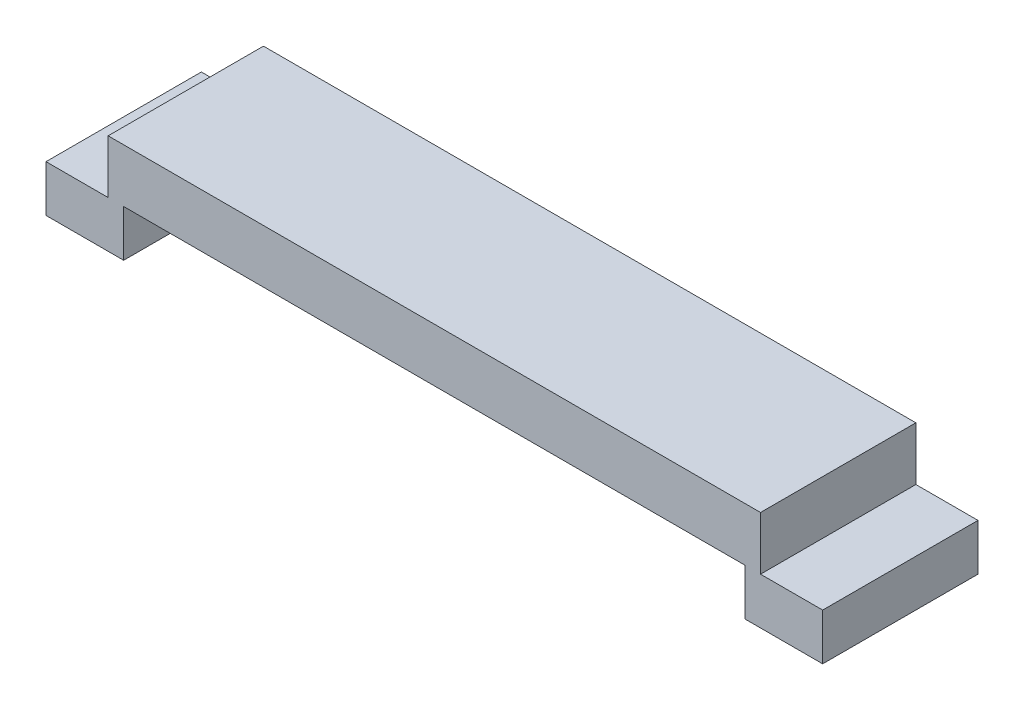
SolidWorks part; units mm, degrees
ref_plane "Front Plane" through (0, 0, 0) normal (0, 0, 1) x (1, 0, 0)
ref_plane "Top Plane" through (0, 0, 0) normal (0, 1, 0) x (1, 0, 0)
ref_plane "Right Plane" through (0, 0, 0) normal (1, 0, 0) x (0, 0, -1)
sketch "Sketch1" plane through (0, 0, 0) normal (0, 0, 1) x (1, 0, 0)
  line L0 (0, 0) -> (0, -30)
  line L1 (0, -30) -> (50, -30)
  line L2 (50, -30) -> (50, 0)
  line L3 (50, 0) -> (0, 0)
  line L4 (40, 0) -> (40, 34.4112)
  line L5 (40, 34.4112) -> (460, 34.4112)
  line L6 (460, 34.4112) -> (460, 0)
  line L7 (460, 0) -> (40, 0)
  line L8 (450, 0) -> (450, -30)
  line L9 (450, -30) -> (500, -30)
  line L10 (500, -30) -> (500, 0)
  line L11 (500, 0) -> (450, 0)
  dimension "D1" = 30
  dimension "D2" = 50
  dimension "D3" = 10
  dimension "D4" = 420
  dimension "D5" = 10
  dimension "D6" = 50
extrude "Boss-Extrude2" add sketch "Sketch1" along normal blind 100 contours L7 L6 L5 L4 L3 | L2 L3 L0 L1 | L10 L11 L7 L8 L9
